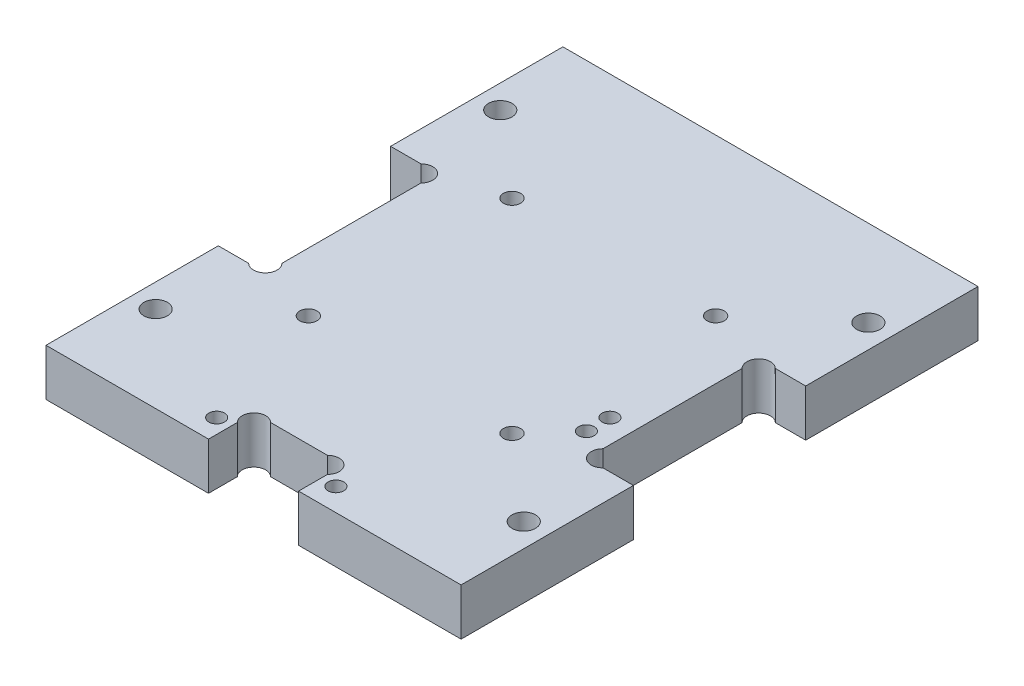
SolidWorks part; units mm, degrees
ref_plane "Plan de face" through (0, 0, 0) normal (0, 0, 1) x (1, 0, 0)
ref_plane "Plan de dessus" through (0, 0, 0) normal (0, 1, 0) x (1, 0, 0)
ref_plane "Plan de droite" through (0, 0, 0) normal (1, 0, 0) x (0, 0, -1)
sketch "Esquisse1" plane through (0, 0, 0) normal (0, 1, 0) x (1, 0, 0)
  line L0 (-111.0793, 0) -> (144.6389, 0) construction
  line L1 (-20.6986, 33) -> (85.418, 33) construction
  line L2 (-20.6986, -33) -> (85.418, -33) construction
  line L3 (-14, 35.404) -> (-14, -5.3706) construction
  line L4 (3.7559, 22) -> (-21.3543, 22) construction
  line L5 (-11, 11) -> (-21.0991, 0.9009) construction
  line L6 (-13.1213, 11) -> (-17, 11)
  line L7 (-13.1213, -11) -> (-17, -11)
  line L8 (-11, -8.8787) -> (-11, 8.8787)
  line L9 (9.5, 8.8787) -> (9.5, -34.2592) construction
  line L10 (30, -8.8787) -> (30, 8.8787)
  line L11 (32.1213, -11) -> (36, -11)
  line L12 (32.1213, 11) -> (36, 11)
  line L13 (44.1725, -43) -> (-30.869, -43) construction
  line L14 (36, -93.4535) -> (36, 65.2255) construction
  line L15 (-16, -93.4535) -> (-16, -38.6395) construction
  line L16 (-111.0793, -63) -> (69.2583, -63) construction
  line L17 (-64.3052, -63) -> (-18, -63) construction
  line L18 (-17, 11) -> (-17, 33)
  line L19 (-16, -61) -> (-16, -47) construction
  line L20 (36, -57.2276) -> (36, -47) construction
  line L21 (-12, -43) -> (32, -43) construction
  line L22 (-17, 33) -> (36, 33)
  line L23 (36, 57.2276) -> (36, 47) construction
  line L24 (-12, 43) -> (32, 43) construction
  line L25 (-16, 61) -> (-16, 47) construction
  line L26 (-64.3052, 63) -> (-18, 63) construction
  line L27 (36, 33) -> (36, 11)
  line L28 (36, -11) -> (36, -33)
  line L29 (36, -33) -> (15.25, -33)
  line L30 (-17, -34.2592) -> (-17, 18.5589) construction
  line L31 (-17, -33) -> (-17, -11)
  line L32 (-11, -14.2655) -> (-11, 33) construction
  line L33 (-17, 11) -> (3.7559, 11) construction
  line L34 (-80, -11.2854) -> (-80, 32.0047) construction
  line L35 (-95, 32.0044) -> (-95, -4) construction
  line L36 (-3.5, -5.3706) -> (-3.5, -18.1922) construction
  line L37 (22.5, -5.3706) -> (22.5, -18.1922) construction
  line L38 (-5.69, -13) -> (26.0323, -13) construction
  line L39 (3.75, -34.2592) -> (3.75, -21.0702) construction
  line L40 (-10.6785, -27.2) -> (21.2749, -27.2) construction
  line L41 (3.75, -27.2) -> (12.8961, -36.3461) construction
  line L42 (-7.1108, -30.1) -> (3.3129, -30.1) construction
  line L43 (1.89, -25.5754) -> (1.89, -30.8493) construction
  line L44 (3.75, -33) -> (3.75, -29.3213)
  line L45 (15.25, -33) -> (15.25, -29.3213)
  line L46 (-75, 32.0047) -> (-75, -11.2854) construction
  line L47 (5.8713, -27.2) -> (13.1287, -27.2)
  line L48 (3.75, -33) -> (-17, -33)
  line L49 (27, -18.1922) -> (27, 15.6605) construction
  line L50 (30, -13) -> (30, -18.1922) construction
  line L51 (24.6367, -5) -> (34.5082, -5) construction
  line L52 (24.6367, -8) -> (34.5082, -8) construction
  arc A0 (39.359, -58.695) -> (39.359, 58.695) centre (-15, 0) ccw construction
  circle A1 centre (-14, 22) radius 1.5
  arc A2 (-11, 8.8787) -> (-13.1213, 11) centre (-12.0607, 9.9393) ccw
  arc A3 (-11, -8.8787) -> (-13.1213, -11) centre (-12.0607, -9.9393) cw
  circle A4 centre (33, 22) radius 1.5
  arc A5 (30, -8.8787) -> (32.1213, -11) centre (31.0607, -9.9393) ccw
  arc A6 (30, 8.8787) -> (32.1213, 11) centre (31.0607, 9.9393) cw
  circle A7 centre (-14, -22) radius 1.5
  circle A8 centre (33, -22) radius 1.5
  arc A9 (36, 47) -> (32, 43) centre (32, 47) cw construction
  arc A10 (-64.3052, 63) -> (-64.3052, -63) centre (-15, 0) ccw construction
  arc A11 (-12, 43) -> (-16, 47) centre (-12, 47) cw construction
  arc A12 (32, -43) -> (36, -47) centre (32, -47) cw construction
  arc A13 (-16, -47) -> (-12, -43) centre (-12, -47) cw construction
  circle A14 centre (22.5, -13) radius 1.1
  circle A15 centre (-3.5, -13) radius 1.1
  circle A16 centre (22.5, 13) radius 1.1
  circle A17 centre (-3.5, 13) radius 1.1
  circle A18 centre (-80, 0) radius 1.1 construction
  arc A19 (5.8713, -27.2) -> (3.75, -29.3213) centre (4.8107, -28.2607) ccw
  circle A20 centre (1.89, -30.1) radius 1
  arc A21 (13.1287, -27.2) -> (15.25, -29.3213) centre (14.1893, -28.2607) cw
  circle A22 centre (-80, 0) radius 9 construction
  circle A23 centre (17.11, -30.1) radius 1
  circle A24 centre (-35, 22) radius 1.1 construction
  circle A25 centre (-35, -22) radius 1.1 construction
  circle A26 centre (27, -5) radius 1
  circle A27 centre (-15, 0) radius 79 construction
  circle A28 centre (-75, 0) radius 1.1 construction
  arc A29 (36, -57.2276) -> (39.359, -58.695) centre (38, -57.2276) ccw construction
  arc A30 (-18, -63) -> (-16, -61) centre (-18, -61) ccw construction
  arc A31 (39.359, 58.695) -> (36, 57.2276) centre (38, 57.2276) ccw construction
  arc A32 (-16, 61) -> (-18, 63) centre (-18, 61) ccw construction
  circle A33 centre (27, -8) radius 1
  point P58 (36, 43)
  point P66 (-16, 43)
  point P69 (36, -61.636)
  point P71 (36, -43)
  point P74 (-16, -43)
  point P150 (-16, -63)
  point P155 (-16, 63)
  dimension "D8" = 6
  dimension "D9" = 45
  dimension "D13" = 52
  dimension "D12" = 13
  dimension "D16" = 4
  dimension "D21" = 3
  dimension "D22" = 5
  dimension "D23" = 3
  dimension "D36" = 2
  dimension "D11" = 26
  dimension "D14" = 5.75
  dimension "D10" = 13
  dimension "D19" = 2.9
  dimension "D2" = 3
  dimension "D4" = 11
  dimension "D5" = 66
  dimension "D6" = 33
  dimension "D7" = 22
  dimension "D15" = 20
  dimension "D17" = 5.8
  dimension "D18" = 45
  dimension "D20" = 1.86
extrude "Extrusion1" add sketch "Esquisse1" along normal blind 6
